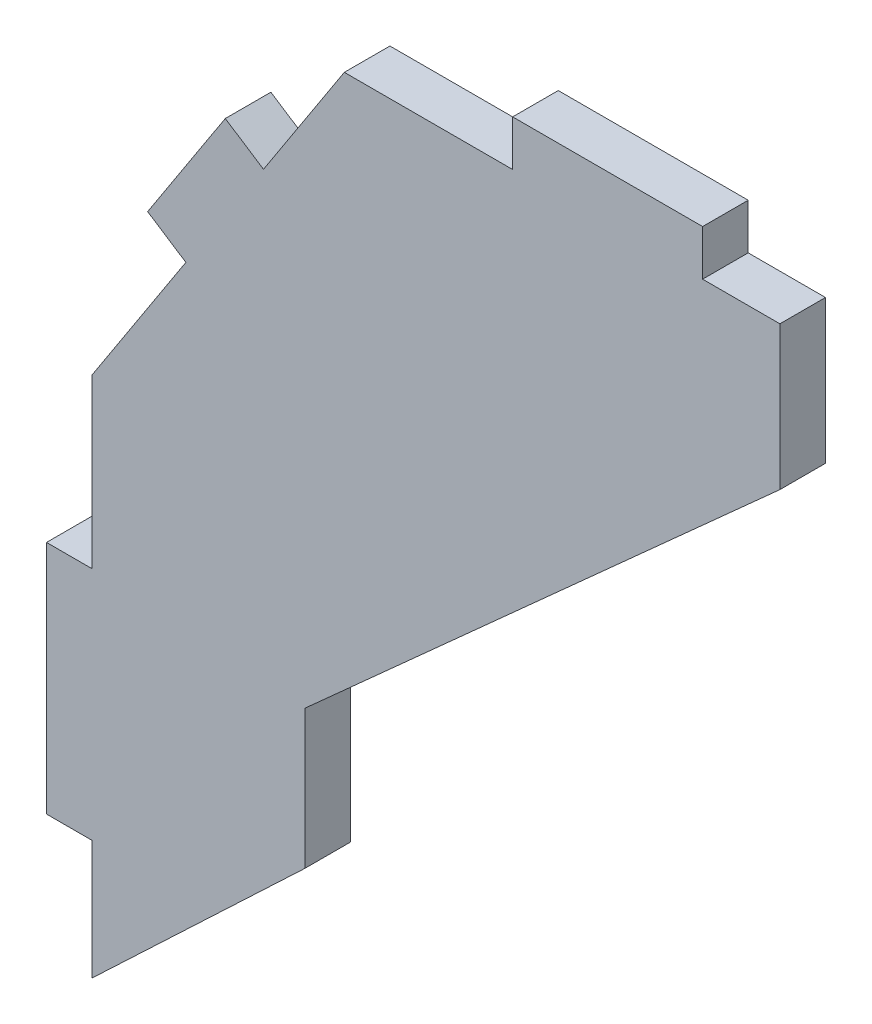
SolidWorks part; units mm, degrees
ref_plane "Front Plane" through (0, 0, 0) normal (0, 0, 1) x (1, 0, 0)
ref_plane "Top Plane" through (0, 0, 0) normal (0, 1, 0) x (1, 0, 0)
ref_plane "Right Plane" through (0, 0, 0) normal (1, 0, 0) x (0, 0, -1)
sketch "Sketch1" plane through (0, 0, 0) normal (0, 0, 1) x (1, 0, 0)
  line L0 (0, 171.8412) -> (-1.524, 171.8412)
  line L1 (-1.524, 171.8412) -> (-1.524, 163.9763)
  line L2 (-1.524, 163.9763) -> (0, 163.9763)
  line L3 (0, 163.9763) -> (0, 159.9932)
  line L4 (0, 159.9932) -> (7.1159, 166.7254)
  line L5 (7.1159, 166.7254) -> (7.1159, 171.3624)
  line L6 (0, 171.8412) -> (0, 177.4532)
  line L7 (0, 177.4532) -> (3.1348, 182.2772)
  line L8 (3.1348, 182.2772) -> (1.8569, 183.1076)
  line L9 (1.8569, 183.1076) -> (4.4519, 187.101)
  line L10 (4.4519, 187.101) -> (5.7298, 186.2706)
  line L11 (5.7298, 186.2706) -> (8.4314, 190.4281)
  line L12 (8.4314, 190.4281) -> (14.0585, 190.4281)
  line L13 (14.0585, 190.4281) -> (14.0585, 191.9521)
  line L14 (14.0585, 191.9521) -> (20.4085, 191.9521)
  line L15 (20.4085, 191.9521) -> (20.4085, 190.4281)
  line L16 (20.4085, 190.4281) -> (22.9917, 190.4281)
  line L17 (22.9917, 190.4281) -> (22.9917, 185.6271)
  line L18 (22.9917, 185.6271) -> (7.1159, 171.3624)
extrude "Boss-Extrude1" add sketch "Sketch1" along normal blind 1.524
